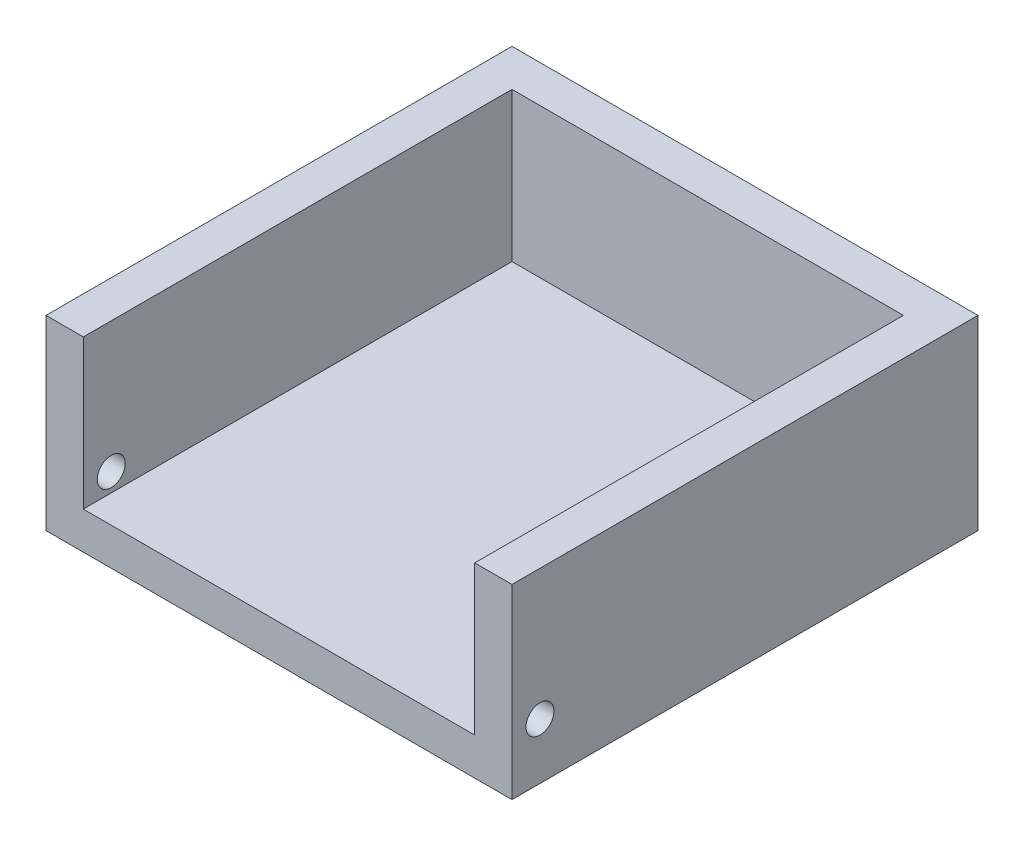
SolidWorks part; units mm, degrees
ref_plane "Plan de face" through (0, 0, 0) normal (0, 0, 1) x (1, 0, 0)
ref_plane "Plan de dessus" through (0, 0, 0) normal (0, 1, 0) x (1, 0, 0)
ref_plane "Plan de droite" through (0, 0, 0) normal (1, 0, 0) x (0, 0, -1)
sketch "Esquisse1" plane through (0, 0, 0) normal (0, 1, 0) x (1, 0, 0)
  line L1 (-25, 25) -> (25, 25)
  line L2 (-25, 25) -> (-25, -25)
  line L3 (-25, -25) -> (25, -25)
  line L4 (25, 25) -> (25, -25)
  line L5 (-25, 25) -> (25, -25) construction
  line L6 (-25, -25) -> (25, 25) construction
  point P0 (0, 0)
  dimension "D1" = 50
  dimension "D2" = 50
extrude "Boss.-Extru.1" add sketch "Esquisse1" along normal blind 4
sketch "Esquisse2" plane through (0, 4, 0) normal (0, 1, 0) x (1, 0, 0)
  line L0 (-25, -25) -> (-25, 25)
  line L1 (-25, 25) -> (25, 25)
  line L2 (25, 25) -> (25, -25)
  line L3 (25, -25) -> (21, -25)
  line L4 (-25, -25) -> (25, -25) construction
  line L5 (21, -25) -> (21, 21)
  line L6 (21, 21) -> (-21, 21)
  line L7 (-21, 21) -> (-21, -25)
  line L8 (-21, -25) -> (-25, -25)
  dimension "D1" = 4
  dimension "D2" = 4
  dimension "D3" = 4
extrude "Boss.-Extru.2" add sketch "Esquisse2" along normal blind 16
sketch "Esquisse3" plane through (-25, 0, 0) normal (-1, 0, 0) x (0, 0, 1)
  line L0 (25, 20) -> (25, 0) construction
  line L1 (-25, 0) -> (25, 0) construction
  circle A0 centre (22, 6) radius 1.5
  dimension "D1" = 3
  dimension "D2" = 3
  dimension "D3" = 6
extrude "Enlèv. mat.-Extru.1" cut sketch "Esquisse3" against normal through all contours A0
